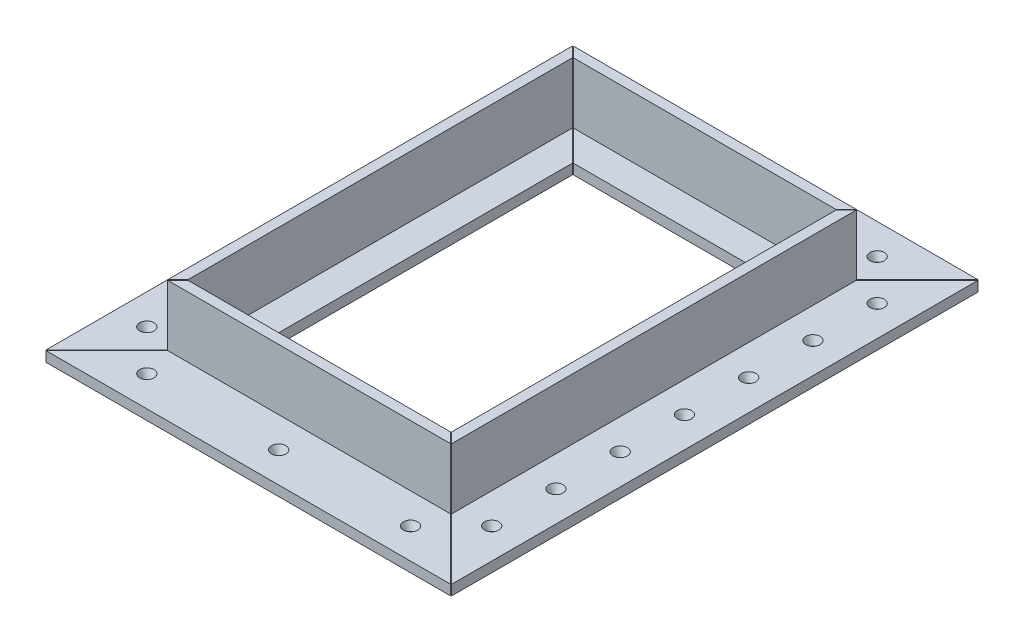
SolidWorks part; units mm, degrees
ref_plane "Front Plane" through (0, 0, 0) normal (0, 0, 1) x (1, 0, 0)
ref_plane "Top Plane" through (0, 0, 0) normal (0, 1, 0) x (1, 0, 0)
ref_plane "Right Plane" through (0, 0, 0) normal (1, 0, 0) x (0, 0, -1)
sketch "Sketch1" plane through (0, 0, 0) normal (0, 0, 1) x (1, 0, 0)
  line L0 (-44.45, 0) -> (-41.275, 0)
  line L1 (-41.275, 0) -> (-41.275, -19.05)
  line L2 (-44.45, 0) -> (-44.45, -19.05)
  line L3 (-44.45, -19.05) -> (-63.5, -19.05)
  line L4 (-63.5, -19.05) -> (-63.5, -22.225)
  line L5 (-63.5, -22.225) -> (-31.75, -22.225)
  line L8 (-31.75, -22.225) -> (-31.75, -19.05)
  line L9 (-31.75, -19.05) -> (-41.275, -19.05)
  line L10 (0, 0) -> (0, -19.05) construction
  line L11 (-41.275, -19.05) -> (41.275, -19.05) construction
  line L12 (-25.4, 0) -> (-22.225, 0) construction
  line L13 (-34.925, -19.05) -> (-31.75, -19.05) construction
  line L14 (-34.925, -19.05) -> (-34.925, 0) construction
  line L15 (-34.925, 0) -> (-31.75, 0) construction
  line L16 (-31.75, -19.05) -> (-31.75, 0) construction
  line L17 (-25.4, -19.05) -> (-25.4, 0) construction
  line L18 (-22.225, -19.05) -> (-22.225, 0) construction
  line L19 (-25.4, -19.05) -> (-22.225, -19.05) construction
  line L20 (-15.875, 0) -> (-12.7, 0) construction
  line L21 (-15.875, -19.05) -> (-15.875, 0) construction
  line L22 (-12.7, -19.05) -> (-12.7, 0) construction
  line L23 (-15.875, -19.05) -> (-12.7, -19.05) construction
  line L24 (-6.35, 0) -> (-3.175, 0) construction
  line L25 (-6.35, -19.05) -> (-6.35, 0) construction
  line L26 (-3.175, -19.05) -> (-3.175, 0) construction
  line L27 (-6.35, -19.05) -> (-3.175, -19.05) construction
  line L28 (3.175, 0) -> (6.35, 0) construction
  line L29 (3.175, -19.05) -> (3.175, 0) construction
  line L30 (6.35, -19.05) -> (6.35, 0) construction
  line L31 (3.175, -19.05) -> (6.35, -19.05) construction
  line L32 (12.7, 0) -> (15.875, 0) construction
  line L33 (12.7, -19.05) -> (12.7, 0) construction
  line L34 (15.875, -19.05) -> (15.875, 0) construction
  line L35 (12.7, -19.05) -> (15.875, -19.05) construction
  line L36 (22.225, 0) -> (25.4, 0) construction
  line L37 (22.225, -19.05) -> (22.225, 0) construction
  line L38 (25.4, -19.05) -> (25.4, 0) construction
  line L39 (22.225, -19.05) -> (25.4, -19.05) construction
  line L40 (31.75, 0) -> (34.925, 0) construction
  line L41 (31.75, -19.05) -> (31.75, 0) construction
  line L42 (34.925, -19.05) -> (34.925, 0) construction
  line L43 (31.75, -19.05) -> (34.925, -19.05) construction
  line L44 (31.75, -22.225) -> (31.75, -19.05)
  line L45 (31.75, -19.05) -> (41.275, -19.05)
  line L46 (63.5, -22.225) -> (31.75, -22.225)
  line L47 (63.5, -19.05) -> (63.5, -22.225)
  line L48 (44.45, -19.05) -> (63.5, -19.05)
  line L49 (44.45, 0) -> (44.45, -19.05)
  line L50 (41.275, 0) -> (41.275, -19.05)
  line L51 (44.45, 0) -> (41.275, 0)
  point P15 (0, -19.05)
  dimension "D1" = 12.7
  dimension "D2" = 3.175
  dimension "D3" = 31.75
  dimension "D4" = 22.225
  dimension "D5" = 6.35
  dimension "D6" = 3.175
  dimension "D8" = 6.35
  dimension "D7" = 8
extrude "Boss-Extrude1" add sketch "Sketch1" along normal mid plane 127
sketch "Sketch2" plane through (0, 0, 0) normal (1, 0, 0) x (0, 0, -1)
  line L0 (-63.5, -19.05) -> (63.5, -19.05) construction
  line L1 (-63.5, 0) -> (-60.325, 0)
  line L2 (-63.5, 0) -> (-63.5, -19.05)
  line L4 (-60.325, 0) -> (-60.325, -19.05)
  line L5 (-63.5, -22.225) -> (63.5, -22.225) construction
  line L6 (-82.55, -19.05) -> (-63.5, -19.05)
  line L7 (-82.55, -19.05) -> (-82.55, -22.225)
  line L8 (-82.55, -22.225) -> (-50.8, -22.225)
  line L9 (-50.8, -19.05) -> (-50.8, -22.225)
  line L10 (-60.325, -19.05) -> (-50.8, -19.05)
  line L11 (-63.5, -22.225) -> (-63.5, -19.05) construction
  line L12 (0, 0) -> (0, -51.8779) construction
  line L13 (60.325, -19.05) -> (50.8, -19.05)
  line L14 (50.8, -19.05) -> (50.8, -22.225)
  line L15 (82.55, -22.225) -> (50.8, -22.225)
  line L16 (82.55, -19.05) -> (82.55, -22.225)
  line L17 (82.55, -19.05) -> (63.5, -19.05)
  line L18 (60.325, 0) -> (60.325, -19.05)
  line L19 (63.5, 0) -> (63.5, -19.05)
  line L20 (63.5, 0) -> (60.325, 0)
  dimension "D1" = 12.7
  dimension "D2" = 31.75
extrude "Boss-Extrude2" add sketch "Sketch2" against normal up to vertex and the other way up to surface
sketch "Sketch3" plane through (0, -19.05, 0) normal (0, 1, 0) x (1, 0, 0)
  line L0 (44.45, 63.5) -> (44.45, 82.55) construction
  line L1 (-44.45, -63.5) -> (-63.5, -63.5) construction
  line L2 (-44.45, -63.5) -> (-44.45, -82.55) construction
  line L3 (-44.45, 63.5) -> (-63.5, 63.5) construction
  line L4 (-44.45, 82.55) -> (-44.45, 63.5) construction
  line L5 (63.5, -63.5) -> (44.45, -63.5) construction
  line L6 (44.45, -82.55) -> (44.45, -63.5) construction
  line L7 (63.5, 63.5) -> (44.45, 63.5) construction
  line L8 (-44.45, 82.55) -> (-44.45, 63.5)
  line L9 (-44.45, 63.5) -> (-63.5, 63.5)
  line L10 (-44.45, -63.5) -> (-63.5, -63.5)
  line L11 (-44.45, -63.5) -> (-44.45, -82.55)
  line L12 (63.5, -63.5) -> (44.45, -63.5)
  line L13 (44.45, -82.55) -> (44.45, -63.5)
  line L14 (63.5, 63.5) -> (44.45, 63.5)
  line L15 (44.45, 63.5) -> (44.45, 82.55)
  line L16 (-63.5, 63.5) -> (-63.5, 82.55)
  line L17 (-63.5, -82.55) -> (-44.45, -82.55)
  line L18 (-63.5, -82.55) -> (-63.5, -63.5)
  line L19 (-63.5, 82.55) -> (-44.45, 82.55)
  line L20 (63.5, -82.55) -> (63.5, -63.5)
  line L21 (44.45, 82.55) -> (63.5, 82.55)
  line L22 (63.5, 63.5) -> (63.5, 82.55)
  line L23 (44.45, -82.55) -> (63.5, -82.55)
extrude "Boss-Extrude3" add sketch "Sketch3" against normal up to surface (3.175 mm away)
sketch "Sketch4" plane through (0, -19.05, 0) normal (0, 1, 0) x (1, 0, 0)
  line L0 (-63.5, -82.55) -> (-63.5, 82.55) construction
  line L1 (-53.975, 73.025) -> (53.975, 73.025) construction
  line L2 (-53.975, 73.025) -> (-53.975, -73.025) construction
  line L3 (-53.975, -73.025) -> (53.975, -73.025) construction
  line L4 (53.975, 73.025) -> (53.975, -73.025) construction
  line L5 (-63.5, -82.55) -> (63.5, -82.55) construction
  line L6 (63.5, -82.55) -> (63.5, 82.55) construction
  line L7 (-63.5, 82.55) -> (63.5, 82.55) construction
  point P12 (-53.975, -60.325)
  point P13 (-41.275, -73.025)
  point P14 (0, -73.025)
  point P15 (41.275, -73.025)
  point P16 (-41.275, 73.025)
  point P17 (0, 73.025)
  point P18 (41.275, 73.025)
  point P20 (-53.975, -40.2167)
  point P21 (-53.975, -20.1083)
  point P22 (-53.975, 0)
  point P23 (-53.975, 20.1083)
  point P24 (-53.975, 40.2167)
  point P25 (-53.975, 60.325)
  point P26 (53.975, -40.2167)
  point P27 (53.975, -20.1083)
  point P28 (53.975, -60.325)
  point P29 (53.975, 0)
  point P30 (53.975, 20.1083)
  point P31 (53.975, 40.2167)
  point P32 (53.975, 60.325)
  dimension "D1" = 9.525
  dimension "D2" = 9.525
  dimension "D3" = 9.525
  dimension "D4" = 9.525
  dimension "D5" = 12.7
  dimension "D8" = 12.7
  dimension "D9" = 12.7
  dimension "D6" = 7
  dimension "D7" = 7
ref_plane "Plane1" through (0, 0, 60.325) normal (0, 0, 1) x (1, 0, 0)
sketch "Sketch5" plane through (0, 0, 60.325) normal (0, 0, 1) x (1, 0, 0)
  line L0 (-53.975, -31.75) -> (-53.975, -20.5396)
  line L1 (-52.9341, -21.3) -> (-51.7245, -19.05)
  line L2 (-53.975, -19.05) -> (-53.975, -20.5396)
  line L3 (-63.5, -19.05) -> (63.5, -19.05) construction
  line L6 (-53.975, -19.05) -> (-51.7245, -19.05)
  line L8 (-52.9341, -21.3) -> (-52.9378, -26.1182)
  line L10 (-53.5799, -27.5501) -> (-53.8568, -27.55)
  line L12 (-53.7059, -28.2227) -> (-53.8816, -28.2226)
  line L14 (-53.7291, -28.9061) -> (-53.8875, -28.906)
  line L16 (-53.8108, -29.5777) -> (-53.8945, -29.5776)
  line L18 (-53.863, -30.2447) -> (-53.9457, -30.2446)
  ellipse E1 centre (-54.0383, -29.901) end of major axis (-54.5022, -29.9009) minor radius 0.3711 (-53.863, -30.2447) -> (-53.8108, -29.5777) ccw
  ellipse E4 centre (-53.9109, -29.2309) end of major axis (-54.3558, -29.2307) minor radius 0.3559 (-53.8108, -29.5777) -> (-53.7291, -28.9061) ccw
  ellipse E5 centre (-53.8004, -28.5626) end of major axis (-54.2357, -28.5624) minor radius 0.3482 (-53.7291, -28.9061) -> (-53.7059, -28.2227) ccw
  ellipse E6 centre (-53.6009, -27.1953) end of major axis (-54.0449, -27.1952) minor radius 0.3551 (-53.5799, -27.5501) -> (-53.7047, -26.85) ccw
  ellipse E8 centre (-53.717, -27.8775) end of major axis (-53.2854, -27.8776) minor radius 0.3453 (-53.7059, -28.2227) -> (-53.5799, -27.5501) ccw
  ellipse E10 centre (-53.8334, -26.1406) end of major axis (-52.9374, -26.141) minor radius 0.7168 (-53.6792, -26.8468) -> (-52.9378, -26.1182) ccw
  ellipse E13 centre (-55.9113, -31.4669) end of major axis (-53.8178, -31.2882) minor radius 1.0596 (-53.975, -31.75) -> (-53.9157, -31.0161) ccw
  ellipse E15 centre (-54.3411, -30.6105) end of major axis (-53.6795, -30.6108) minor radius 0.5293 (-53.9157, -31.0161) -> (-53.863, -30.2447) ccw
  dimension "D1" = 12.7
revolve "Cut-Revolve1" cut sketch "Sketch5" angle 360 about L0
sketch "Sketch6" plane through (0, -19.05, 0) normal (0, 1, 0) x (1, 0, 0)
  point P0 (-53.975, 20.1083)
  point P2 (-53.975, 0)
  point P4 (-53.975, 40.2167)
  point P6 (-53.975, 60.325)
  point P8 (-41.275, 73.025)
  point P10 (0, 73.025)
  point P12 (41.275, 73.025)
  point P14 (53.975, 0)
  point P16 (53.975, 20.1083)
  point P18 (53.975, 40.2167)
  point P20 (53.975, 60.325)
  point P22 (53.975, -40.2167)
  point P24 (53.975, -20.1083)
  point P26 (53.975, -60.325)
  point P28 (41.275, -73.025)
  point P30 (0, -73.025)
  point P32 (-41.275, -73.025)
  point P34 (-53.975, -40.2167)
  point P36 (-53.975, -20.1083)
pattern_sketch "Sketch-Pattern1" of "Cut-Revolve1"
sketch "Sketch7" plane through (0, -19.05, 0) normal (0, 1, 0) x (1, 0, 0)
  circle A4 centre (-38.1, 34.925) radius 1.5875
  circle A5 centre (38.1, 34.925) radius 1.5875
  circle A6 centre (38.1, -34.925) radius 1.5875
  circle A7 centre (-38.1, -34.925) radius 1.5875
extrude "Cut-Extrude1" [suppressed] cut sketch "Sketch7" against normal through all both and the other way through all
sketch "Sketch8" plane through (0, -19.05, 0) normal (0, 1, 0) x (1, 0, 0)
  line L0 (63.5, 82.55) -> (44.45, 63.5)
  line L1 (44.45, 63.5) -> (41.275, 60.325)
  line L2 (41.275, 60.325) -> (31.75, 50.8)
  line L3 (31.75, -50.8) -> (41.275, -60.325)
  line L4 (41.275, -60.325) -> (44.45, -63.5)
  line L5 (44.45, -63.5) -> (63.5, -82.55)
  line L6 (-31.75, -50.8) -> (-41.275, -60.325)
  line L7 (-41.275, -60.325) -> (-44.45, -63.5)
  line L8 (-44.45, -63.5) -> (-63.5, -82.55)
  line L9 (-63.5, 82.55) -> (-44.45, 63.5)
  line L10 (-44.45, 63.5) -> (-41.275, 60.325)
  line L11 (-41.275, 60.325) -> (-31.75, 50.8)
  line L12 (-31.75, 50.8) -> (-6.5999, 25.6499)
  line L13 (6.2964, 25.3464) -> (31.75, 50.8)
  line L14 (31.75, -50.8) -> (3.9862, -23.0362)
  line L15 (-15.0584, -34.1084) -> (-31.75, -50.8)
extrude "Cut-Extrude-Thin1" cut sketch "Sketch8" against normal through all both and the other way through all thin
